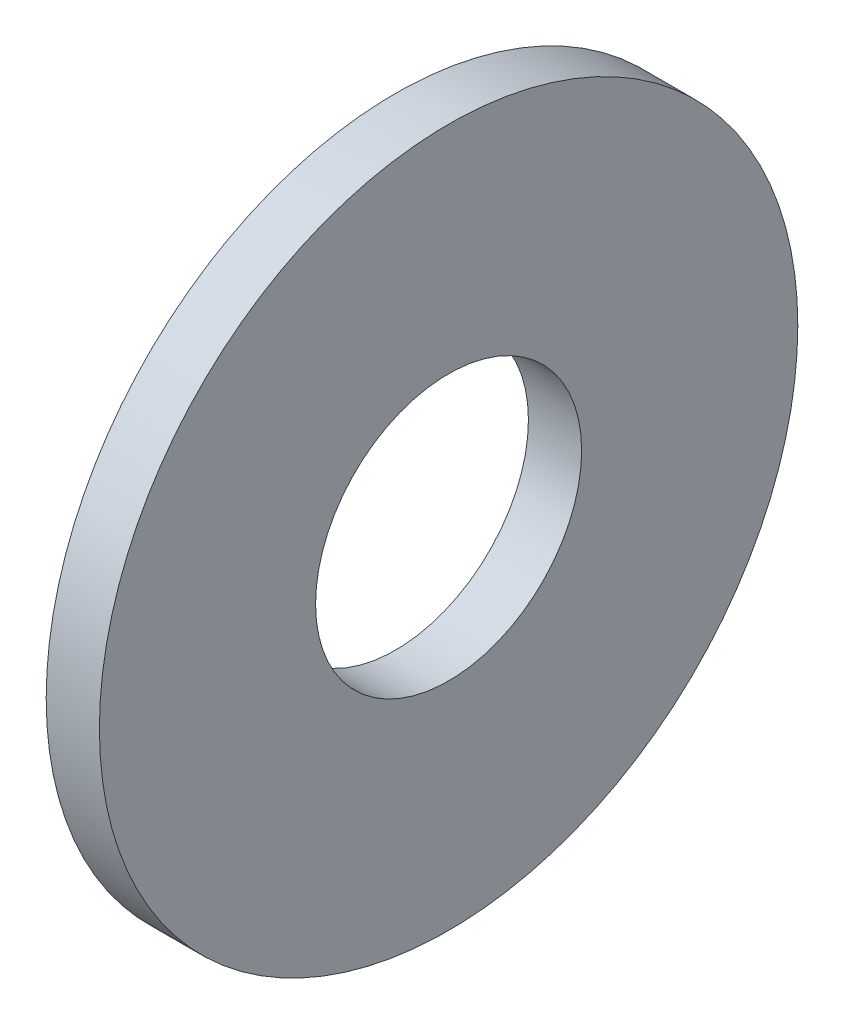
SolidWorks part; units mm, degrees
ref_plane "Front Plane" through (0, 0, 0) normal (0, 0, 1) x (1, 0, 0)
ref_plane "Top Plane" through (0, 0, 0) normal (0, 1, 0) x (1, 0, 0)
ref_plane "Right Plane" through (0, 0, 0) normal (1, 0, 0) x (0, 0, -1)
ref_plane "Plan1" through (0, 0, 0) normal (0, 0, -1) x (-1, 0, 0)
sketch "Esquisse1" plane through (0, 0, 0) normal (0, 0, -1) x (-1, 0, 0)
  line L0 (0.8, 10.5) -> (-0.8, 10.5)
  line L1 (-0.8, 10.5) -> (-0.8, 4)
  line L2 (-0.8, 4) -> (0.8, 4)
  line L3 (0.8, 4) -> (0.8, 10.5)
  line L4 (-0.8, 0) -> (0.8, 0) construction
revolve "Révolution1" add sketch "Esquisse1" angle 360 about L4
